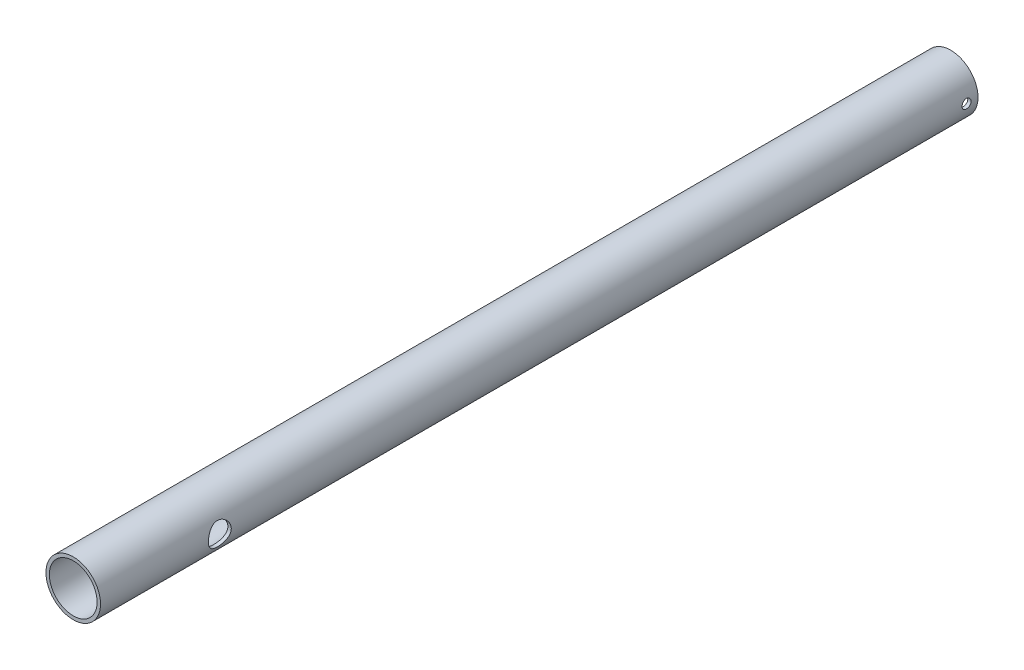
SolidWorks part; units mm, degrees
ref_plane "Plan de face" through (0, 0, 0) normal (0, 0, 1) x (1, 0, 0)
ref_plane "Plan de dessus" through (0, 0, 0) normal (0, 1, 0) x (1, 0, 0)
ref_plane "Plan de droite" through (0, 0, 0) normal (1, 0, 0) x (0, 0, -1)
sketch "Esquisse1" plane through (0, 0, 0) normal (0, 0, 1) x (1, 0, 0)
  circle A0 centre (0, 0) radius 24
  circle A1 centre (0, 0) radius 21
extrude "Extrusion1" add sketch "Esquisse1" along normal blind 772
sketch "Esquisse2" plane through (0, 0, 0) normal (1, 0, 0) x (0, 0, -1)
  line L0 (-772, 24) -> (-772, -24) construction
  circle A0 centre (-667, 0) radius 10.05
  dimension "D1" = 105
extrude "Enlèv. mat.-Extru.1" cut sketch "Esquisse2" against normal mid plane 52
sketch "Esquisse3" plane through (0, 0, 0) normal (1, 0, 0) x (0, 0, -1)
  line L0 (0, -24) -> (0, 24) construction
  circle A0 centre (-10, 0) radius 4
  dimension "D1" = 10
extrude "Enlèv. mat.-Extru.2" cut sketch "Esquisse3" against normal mid plane 52
